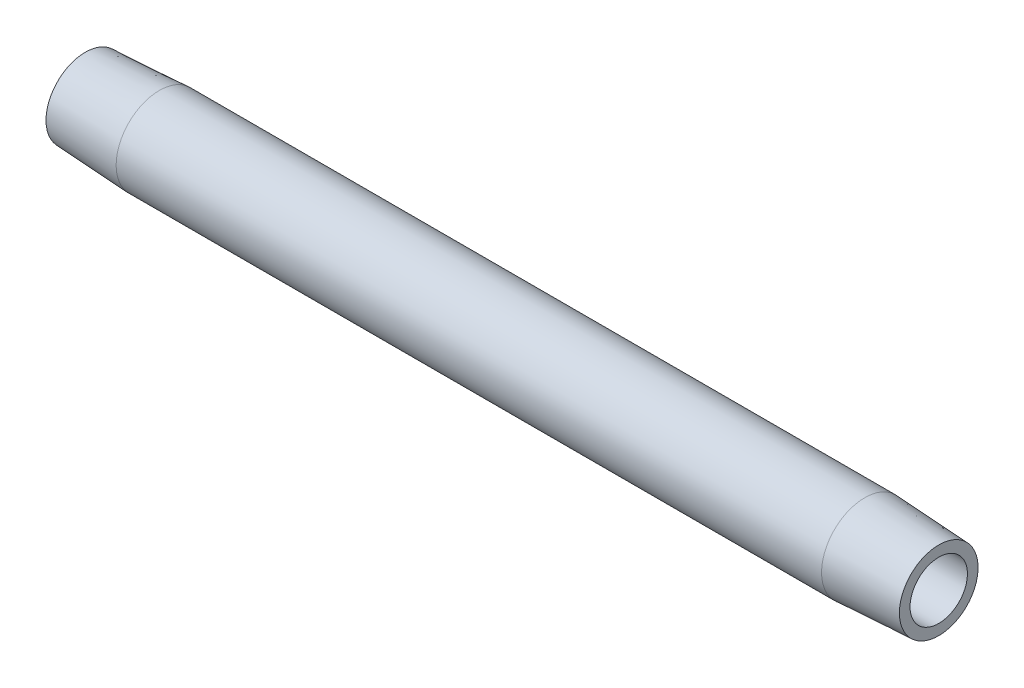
SolidWorks part; units mm, degrees
ref_plane "Front Plane" through (0, 0, 0) normal (0, 0, 1) x (1, 0, 0)
ref_plane "Top Plane" through (0, 0, 0) normal (0, 1, 0) x (1, 0, 0)
ref_plane "Right Plane" through (0, 0, 0) normal (1, 0, 0) x (0, 0, -1)
sketch "Sketch2" plane through (0, 0, 0) normal (0, 0, 1) x (1, 0, 0)
  line L0 (0.4761, 0) -> (50000.4761, 0) construction
  line L1 (0, -11.3625) -> (0, 49988.6375) construction
  line L7 (8.81, 5.1435) -> (0, 4.6818)
  line L8 (92.79, 5.1435) -> (8.81, 5.1435)
  line L9 (101.6, 4.6818) -> (92.79, 5.1435)
  line L10 (101.6, 3.4163) -> (101.6, 4.6818)
  line L11 (101.6, 3.4163) -> (0, 3.4163)
  line L12 (0, 4.6818) -> (0, 3.4163)
  dimension "D1" = 6.8326
  dimension "D2" = 10.287
  dimension "D3" = 3
  dimension "D4" = 3
  dimension "D5" = 8.81
  dimension "D6" = 8.81
  dimension "D7" = 101.6
revolve "Revolve1" add sketch "Sketch2" angle 360 about L0
